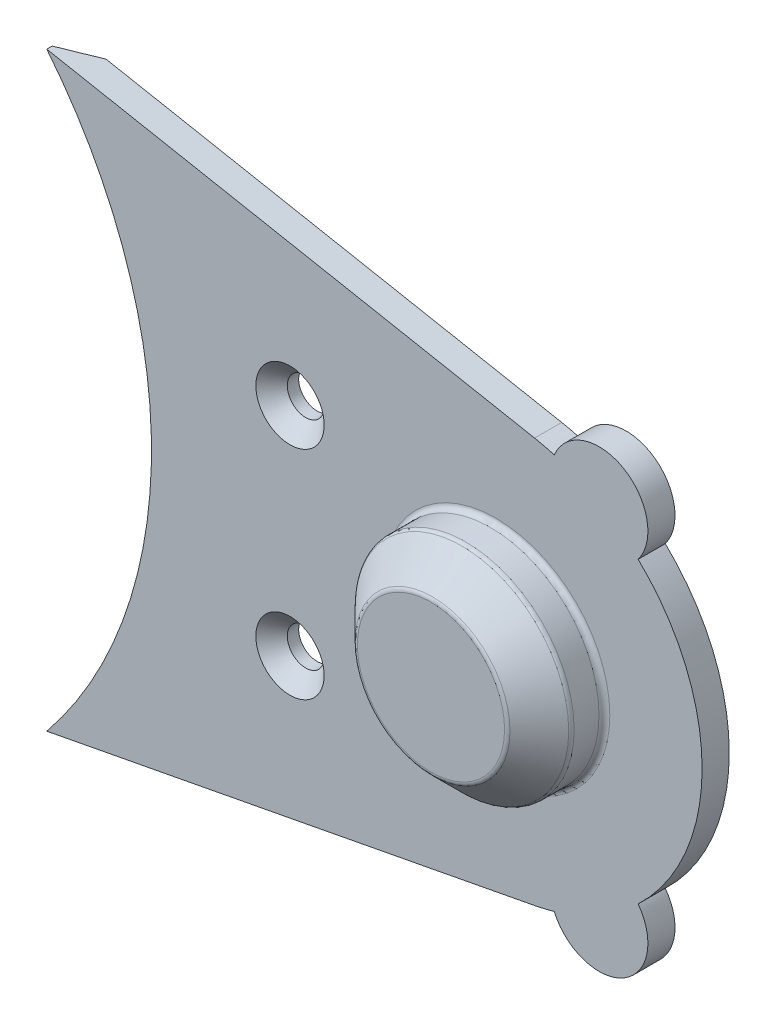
SolidWorks part; units mm, degrees
ref_plane "Plan de face" through (0, 0, 0) normal (0, 0, 1) x (1, 0, 0)
ref_plane "Plan de dessus" through (0, 0, 0) normal (0, 1, 0) x (1, 0, 0)
ref_plane "Plan de droite" through (0, 0, 0) normal (1, 0, 0) x (0, 0, -1)
sketch "Esquisse1" plane through (0, 0, 0) normal (0, 0, 1) x (1, 0, 0)
  line L0 (-64.3899, 0) -> (0, 0) construction
  line L1 (0, -55.9046) -> (0, 54.467) construction
  line L2 (75, -41.7813) -> (75, 24.8253) construction
  line L3 (33.5734, 27.2316) -> (78.5548, 18.6645)
  line L4 (33.5734, -27.2316) -> (78.5548, -18.6645)
  line L5 (75, 0) -> (91.9054, 29.281) construction
  line L6 (75, 0) -> (91.1299, -27.9378) construction
  line L7 (75, 0) -> (132.0405, 0) construction
  arc A1 (78.5548, -18.6645) -> (80.3639, -18.2272) centre (75, 0) ccw
  arc A2 (88.1032, 13.7588) -> (80.3639, 18.2272) centre (84.5, 16.4545) ccw
  arc A3 (80.3639, -18.2272) -> (88.1032, -13.7588) centre (84.5, -16.4545) ccw
  arc A4 (80.3639, 18.2272) -> (78.5548, 18.6645) centre (75, 0) ccw
  arc A5 (88.1032, -13.7588) -> (88.1032, 13.7588) centre (75, 0) ccw
  arc A7 (33.5734, -27.2316) -> (33.5734, 27.2316) centre (0, 0) ccw
  dimension "D2" = 45.79
  dimension "D3" = 38
  dimension "D6" = 9
  dimension "D7" = 9
  dimension "D1" = 75
  dimension "D4" = 60
  dimension "D5" = 60
  dimension "D8" = 21.567
  dimension "D9" = 10.783
extrude "Extrusion1" add sketch "Esquisse1" along normal blind 2.5
sketch "Esquisse25" plane through (0, 0, 2.5) normal (0, 0, 1) x (1, 0, 0)
  circle A0 centre (75, 0) radius 9.9912
extrude "Extrusion2" add sketch "Esquisse25" along normal blind 6
chamfer "Chanfrein1" distance 3 angle 45 1 edges at (84.9912, 0, 8.5)
hole_wizard "Fraisage pour vis à tête fraisée M31" positions "Esquisse27" profile "Esquisse26" countersink size "M3" standard "ISO"
sketch "Esquisse27" plane through (0, 0, 2.5) normal (0, 0, 1) x (1, 0, 0)
  line L0 (0, 0) -> (62.959, 0) construction
  point P0 (56, -10)
  point P6 (56, 10)
  dimension "D1" = 56
  dimension "D2" = 10
  dimension "D3" = 10
sketch "Esquisse26" plane through (56, -10, 2.5) normal (1, 0, 0) x (0, -1, 0)
  line L0 (0, 0) -> (0, 2.5)
  line L1 (0, 2.5) -> (1.7, 2.5)
  line L2 (1.7, 2.5) -> (1.7, 1.45)
  line L3 (1.7, 1.45) -> (3.15, 0)
  line L5 (3.15, 0) -> (0, 0)
  line L6 (-1.7, 1.45) -> (-3.15, 0) construction
  line L11 (0, -6.35) -> (0, 107.95) construction
  dimension "Diamètre du perçage jusqu'au prochain" = 3.4
  dimension "Profondeur du perçage jusqu'au prochain" = 2.5
  dimension "Diamètre du fraisage entrant" = 6.3
  dimension "Angle du fraisage entrant" = 90
sketch "Esquisse28" plane through (0, 0, 0) normal (0, 0, -1) x (-1, 0, 0)
  circle A0 centre (-75, 0) radius 9
  dimension "D1" = 18
extrude "Enlèv. mat.-Extru.1" cut sketch "Esquisse28" against normal blind 5
fillet "Congé1" radius 0.5 5 edges at (66, 0, 0) (66, 0, 5) (81.9912, 0, 8.5) (84.9912, 0, 2.5) (84.9912, 0, 5.5)
chamfer "Chanfrein2" distance 2 angle 45 1 edges at (43.2289, 0, 0)
